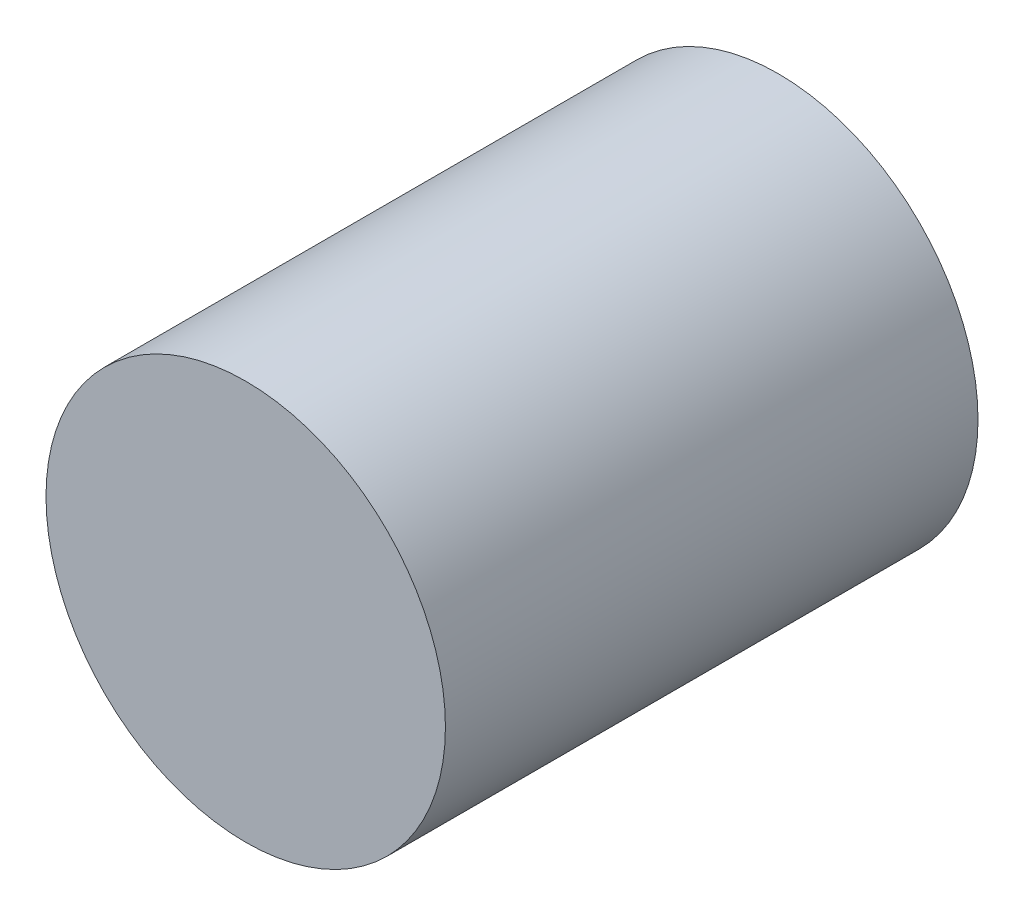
SolidWorks part; units mm, degrees
ref_plane "Plan de face" through (0, 0, 0) normal (0, 0, 1) x (1, 0, 0)
ref_plane "Plan de dessus" through (0, 0, 0) normal (0, 1, 0) x (1, 0, 0)
ref_plane "Plan de droite" through (0, 0, 0) normal (1, 0, 0) x (0, 0, -1)
sketch "Esquisse1" plane through (0, 0, 0) normal (0, 0, 1) x (1, 0, 0)
  circle A0 centre (0, 0) radius 1.125
  dimension "D1" = 2.25
extrude "Extrusion1" add sketch "Esquisse1" along normal blind 3
